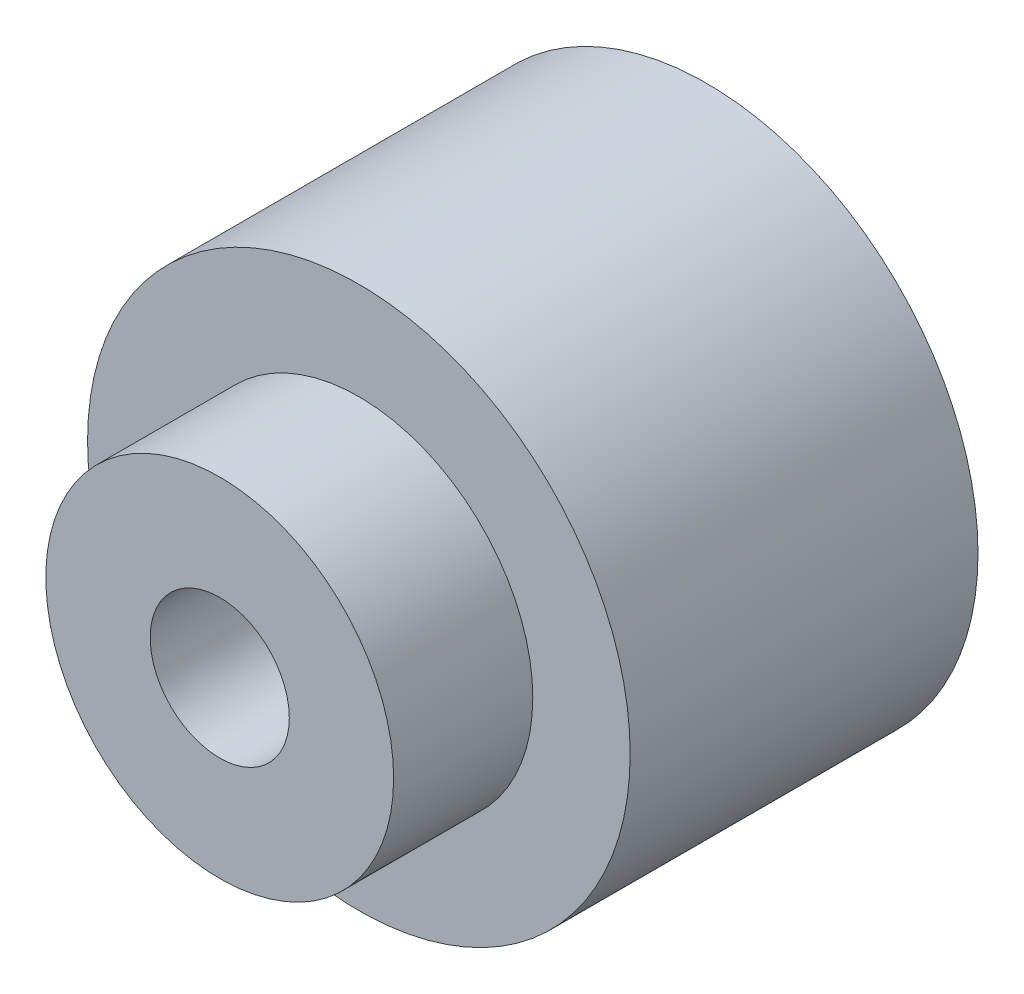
SolidWorks part; units mm, degrees
ref_plane "Piano frontale" through (0, 0, 0) normal (0, 0, 1) x (1, 0, 0)
ref_plane "Piano superiore" through (0, 0, 0) normal (0, 1, 0) x (1, 0, 0)
ref_plane "Piano destro" through (0, 0, 0) normal (1, 0, 0) x (0, 0, -1)
sketch "Schizzo1" plane through (0, 0, 0) normal (0, 0, 1) x (1, 0, 0)
  circle A0 centre (0, 0) radius 39
  dimension "D1" = 78
extrude "Estrusione-Estrusione1" add sketch "Schizzo1" along normal blind 50 contours A0
sketch "Schizzo2" plane through (0, 0, 50) normal (0, 0, 1) x (1, 0, 0)
  circle A0 centre (0, 0) radius 25
  dimension "D1" = 50
extrude "Estrusione-Estrusione2" add sketch "Schizzo2" along normal blind 20 contours A0
sketch "Schizzo3" plane through (0, 0, 70) normal (0, 0, 1) x (1, 0, 0)
  circle A0 centre (0, 0) radius 10
  dimension "D1" = 20
extrude "Taglio-Estrusione1" cut sketch "Schizzo3" against normal through all contours A0
